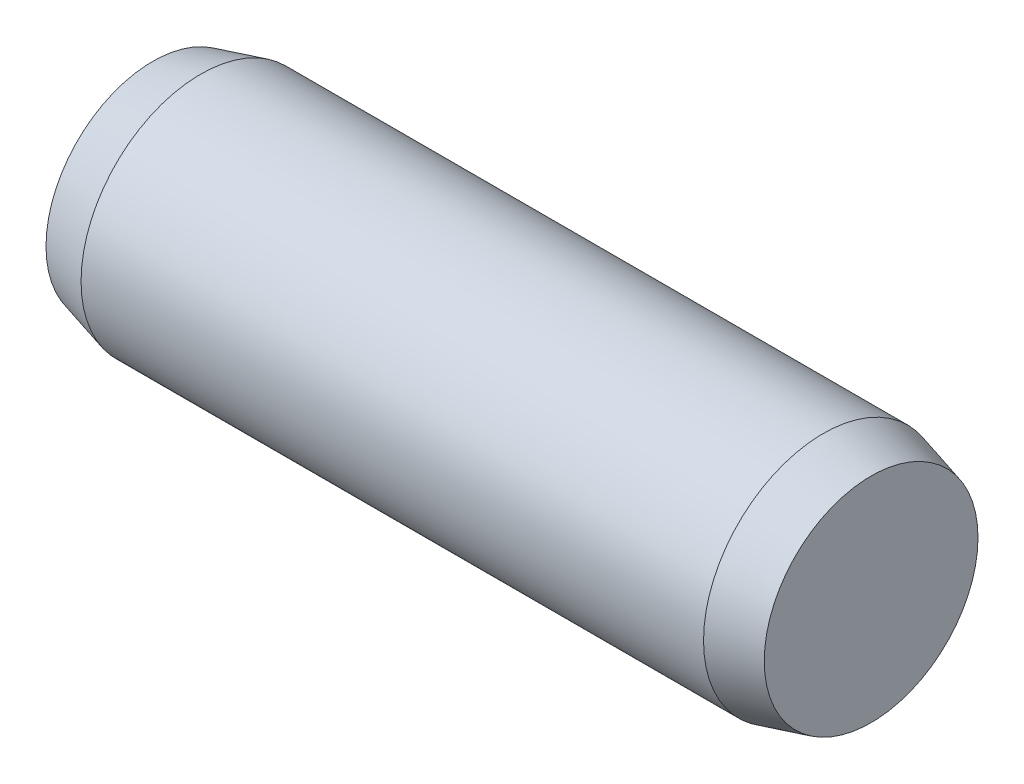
SolidWorks part; units mm, degrees
ref_plane "Front" through (0, 0, 0) normal (0, 0, 1) x (1, 0, 0)
ref_plane "Top" through (0, 0, 0) normal (0, 1, 0) x (1, 0, 0)
ref_plane "Right" through (0, 0, 0) normal (1, 0, 0) x (0, 0, -1)
sketch "Sketch1" plane through (0, 0, 0) normal (0, 0, 1) x (1, 0, 0)
  line L0 (0, 0) -> (3, 0)
  line L1 (3, 0) -> (3, 0.4464)
  line L2 (3, 0.4464) -> (2.8, 0.5)
  line L3 (2.8, 0.5) -> (0.2, 0.5)
  line L4 (0.2, 0.5) -> (0, 0.4464)
  line L5 (0, 0.4464) -> (0, 0)
  line L6 (-6.9767, 0) -> (2.6973, 0) construction
  dimension "l" = 3
  dimension "D2" = 15
  dimension "D3" = 15
  dimension "d" = 1
  dimension "c" = 0.2
  dimension "D6" = 0.2
revolve "Base-Revolve" add sketch "Sketch1" angle 360 about L6
equation "\"D6@Sketch1\" = \"c@Sketch1\""
